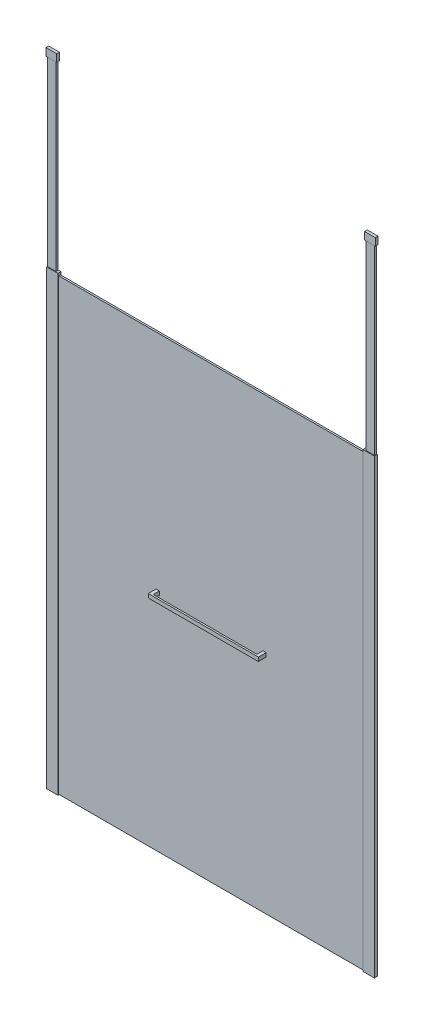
SolidWorks part; units mm, degrees
ref_plane "Płaszczyzna przednia" through (0, 0, 0) normal (0, 0, 1) x (1, 0, 0)
ref_plane "Płaszczyzna górna" through (0, 0, 0) normal (0, 1, 0) x (1, 0, 0)
ref_plane "Płaszczyzna prawa" through (0, 0, 0) normal (1, 0, 0) x (0, 0, -1)
sketch "Szkic1" plane through (0, 0, 0) normal (0, 1, 0) x (1, 0, 0)
  line L0 (0, 0) -> (0, 14)
  line L1 (0, 14) -> (53, 14)
  line L2 (53, 14) -> (53, 11)
  line L3 (53, 11) -> (42.9, 11)
  line L4 (42.9, 11) -> (42.9, 3)
  line L5 (42.9, 3) -> (53, 3)
  line L6 (53, 3) -> (53, 0)
  line L7 (53, 0) -> (0, 0)
  dimension "D1" = 53
  dimension "D2" = 14
  dimension "D3" = 10.1
  dimension "D4" = 3
  dimension "D5" = 8
extrude "Dodanie-wyciągnięcie1" add sketch "Szkic1" along normal blind 2100 from offset 3
sketch "Szkic2" plane through (0, 3, 0) normal (0, -1, 0) x (1, 0, 0)
  line L0 (42.9, -11) -> (53, -11) construction
  line L1 (42.9, -3) -> (1489.9, -3)
  line L2 (42.9, -3) -> (42.9, -11)
  line L3 (42.9, -11) -> (1489.9, -11)
  line L4 (1489.9, -3) -> (1489.9, -11)
  dimension "D1" = 1447
extrude "Dodanie-wyciągnięcie2" add sketch "Szkic2" against normal blind 2100 separate body
sketch "Szkic3" plane through (0, 3, 0) normal (0, -1, 0) x (1, 0, 0)
  line L0 (1479.8, -3) -> (1479.8, 0)
  line L1 (1489.9, -3) -> (42.9, -3) construction
  line L2 (1479.8, 0) -> (1532.8, 0)
  line L3 (1532.8, 0) -> (1532.8, -14)
  line L4 (1532.8, -14) -> (1479.8, -14)
  line L5 (1479.8, -14) -> (1479.8, -11)
  line L6 (1479.8, -11) -> (1489.9, -11)
  line L7 (1489.9, -11) -> (1489.9, -3)
  line L8 (1489.9, -3) -> (1479.8, -3)
  line L9 (42.9, -11) -> (1489.9, -11) construction
  line L10 (1489.9, -11) -> (1489.9, -3) construction
  dimension "D1" = 10.1
  dimension "D2" = 3
  dimension "D3" = 3
  dimension "D4" = 53
extrude "Dodanie-wyciągnięcie3" add sketch "Szkic3" against normal blind 2108 separate body
sketch "Szkic4" plane through (0, 2103, 0) normal (0, 1, 0) x (1, 0, 0)
  line L1 (0, 14) -> (53, 14)
  line L2 (0, 14) -> (0, 0)
  line L3 (0, 0) -> (53, 0)
  line L4 (53, 14) -> (53, 0)
extrude "Dodanie-wyciągnięcie4" add sketch "Szkic4" along normal blind 11
sketch "Szkic5" plane through (0, 2111, 0) normal (0, 1, 0) x (1, 0, 0)
  line L1 (1532.8, 14) -> (1479.8, 14)
  line L2 (1532.8, 14) -> (1532.8, 0)
  line L3 (1532.8, 0) -> (1479.8, 0)
  line L4 (1479.8, 14) -> (1479.8, 0)
extrude "Dodanie-wyciągnięcie5" add sketch "Szkic5" along normal blind 3
sketch "Szkic6" plane through (1479.8, 0, 0) normal (-1, 0, 0) x (0, 0, 1)
  line L0 (-11, 2111) -> (-3, 2111) construction
  line L1 (-2.95, 2111) -> (-11.05, 2111)
  line L2 (-2.95, 2111) -> (-2.95, 2103.2)
  line L3 (-2.95, 2103.2) -> (-11.05, 2103.2)
  line L4 (-11.05, 2111) -> (-11.05, 2103.2)
  point P6 (-7, 2111)
  dimension "D1" = 8.1
  dimension "D2" = 7.8
extrude "Dodanie-wyciągnięcie6" add sketch "Szkic6" against normal blind 15
sketch "Szkic7" plane through (0, 3, 0) normal (0, -1, 0) x (1, 0, 0)
  line L1 (1479.8, 0) -> (1532.8, 0)
  line L2 (1479.8, 0) -> (1479.8, -14)
  line L3 (1479.8, -14) -> (1532.8, -14)
  line L4 (1532.8, 0) -> (1532.8, -14)
extrude "Dodanie-wyciągnięcie7" add sketch "Szkic7" along normal blind 3
sketch "Szkic8" plane through (0, 3, 0) normal (0, -1, 0) x (1, 0, 0)
  line L1 (0, 0) -> (53, 0)
  line L2 (0, 0) -> (0, -14)
  line L3 (0, -14) -> (53, -14)
  line L4 (53, 0) -> (53, -14)
extrude "Dodanie-wyciągnięcie8" add sketch "Szkic8" along normal blind 3
sketch "Szkic9" plane through (0, 2114, 2099.6) normal (0, -1, 0) x (-1, 0, 0)
  line L0 (0, 2113.6) -> (0, 2099.6) construction
  line L1 (-1531.3, 2110.6) -> (-1491.3, 2110.6)
  line L2 (-1531.3, 2110.6) -> (-1531.3, 2102.6)
  line L3 (-1531.3, 2102.6) -> (-1491.3, 2102.6)
  line L4 (-1491.3, 2110.6) -> (-1491.3, 2102.6)
  line L5 (-1.5, 2102.6) -> (-41.5, 2102.6)
  line L6 (-1.5, 2102.6) -> (-1.5, 2110.6)
  line L7 (-1479.8, 2113.6) -> (-1532.8, 2113.6) construction
  line L8 (-1532.8, 2113.6) -> (-1532.8, 2099.6) construction
  line L9 (-1.5, 2110.6) -> (-41.5, 2110.6)
  line L10 (-41.5, 2102.6) -> (-41.5, 2110.6)
  line L11 (-53, 2113.6) -> (0, 2113.6) construction
  dimension "D1" = 3
  dimension "D2" = 1.5
  dimension "D3" = 8
  dimension "D4" = 40
  dimension "D5" = 1.5
  dimension "D6" = 40
  dimension "D7" = 3
  dimension "D8" = 8
extrude "Dodanie-wyciągnięcie9" add sketch "Szkic9" against normal blind 883 separate body
sketch "Szkic10" plane through (0, 2997, 0) normal (0, 1, 0) x (-1, 0, 0)
  line L0 (-1491.3, -3) -> (-1491.3, -11) construction
  line L1 (-1536.3, -0.75) -> (-1486.3, -0.75)
  line L2 (-1536.3, -0.75) -> (-1536.3, -13.25)
  line L3 (-1536.3, -13.25) -> (-1486.3, -13.25)
  line L4 (-1486.3, -0.75) -> (-1486.3, -13.25)
  line L5 (-1536.3, -0.75) -> (-1486.3, -13.25) construction
  line L6 (-1536.3, -13.25) -> (-1486.3, -0.75) construction
  line L8 (-1511.3, -7) -> (-1531.3, -7) construction
  line L9 (-1531.3, -11) -> (-1531.3, -3) construction
  line L10 (-21.5, -11) -> (-21.5, -7) construction
  line L11 (3.5, -13.25) -> (-46.5, -13.25)
  line L12 (3.5, -13.25) -> (3.5, -0.75)
  line L13 (3.5, -0.75) -> (-46.5, -0.75)
  line L14 (-46.5, -13.25) -> (-46.5, -0.75)
  line L15 (3.5, -13.25) -> (-46.5, -0.75) construction
  line L16 (3.5, -0.75) -> (-46.5, -13.25) construction
  line L17 (-1.5, -11) -> (-41.5, -11) construction
  line L18 (-21.5, -7) -> (-1.5, -7) construction
  line L19 (-1.5, -3) -> (-1.5, -11) construction
  point P0 (-1511.3, -7)
  point P9 (-21.5, -7)
  dimension "D1" = 12.5
  dimension "D2" = 50
  dimension "D3" = 50
  dimension "D4" = 12.5
  dimension "D5" = 5
extrude "Dodanie-wyciągnięcie10" add sketch "Szkic10" along normal blind 35 from offset 32
ref_plane "Płaszczyzna1" through (1511.3, 0, 0) normal (1, 0, 0) x (0, 0, -1)
sketch "Szkic12" plane through (0, 0, -3) normal (0, 0, 1) x (1, 0, 0)
  line L0 (766.4, 1409.7928) -> (766.4, 762.3594) construction
  line L1 (516.4, 1053) -> (1016.4, 1053) construction
  line L2 (42.9, 2103) -> (42.9, 3) construction
  line L3 (1489.9, 2103) -> (1489.9, 3) construction
  line L5 (508.9, 1062) -> (523.9, 1062)
  line L6 (508.9, 1062) -> (508.9, 1044)
  line L7 (508.9, 1044) -> (523.9, 1044)
  line L8 (523.9, 1062) -> (523.9, 1044)
  line L9 (508.9, 1062) -> (523.9, 1044) construction
  line L10 (508.9, 1044) -> (523.9, 1062) construction
  line L11 (1008.9, 1062) -> (1023.9, 1062)
  line L12 (1008.9, 1062) -> (1008.9, 1044)
  line L13 (1008.9, 1044) -> (1023.9, 1044)
  line L14 (1023.9, 1062) -> (1023.9, 1044)
  line L15 (1008.9, 1062) -> (1023.9, 1044) construction
  line L16 (1008.9, 1044) -> (1023.9, 1062) construction
  dimension "D1" = 1053
  dimension "D2" = 500
  dimension "D3" = 15
  dimension "D4" = 18
extrude "Dodanie-wyciągnięcie11" add sketch "Szkic12" along normal blind 36.5 and the other way blind 18 separate body
sketch "Szkic13" plane through (523.9, 0, 0) normal (1, 0, 0) x (0, 0, -1)
  line L0 (21, 1044) -> (-33.5, 1044) construction
  line L1 (-33.5, 1062) -> (-25.5, 1062)
  line L2 (-33.5, 1062) -> (-33.5, 1044)
  line L3 (-33.5, 1044) -> (-25.5, 1044)
  line L4 (-25.5, 1062) -> (-25.5, 1044)
  dimension "D1" = 8
extrude "Dodanie-wyciągnięcie12" add sketch "Szkic13" along normal up to surface (485 mm away)
